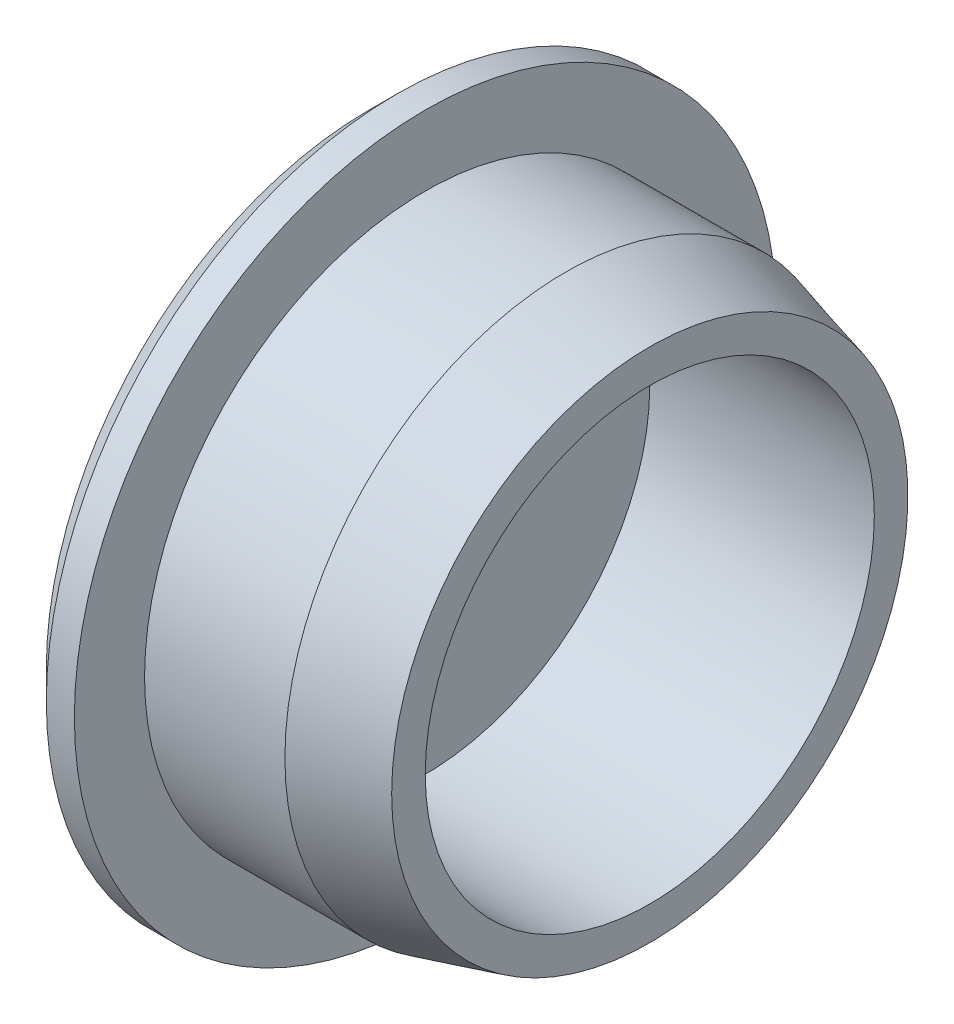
SolidWorks part; units mm, degrees
ref_plane "Plan de face" through (0, 0, 0) normal (0, 0, 1) x (1, 0, 0)
ref_plane "Plan de dessus" through (0, 0, 0) normal (0, 1, 0) x (1, 0, 0)
ref_plane "Plan de droite" through (0, 0, 0) normal (1, 0, 0) x (0, 0, -1)
sketch "Esquisse1" plane through (0, 0, 0) normal (0, 0, 1) x (1, 0, 0)
  line L0 (0, 9.1962) -> (-3, 10)
  line L1 (0, -55) -> (0, 55) construction
  line L2 (-3, 10) -> (-8, 10)
  line L3 (-8, 10) -> (-8, 12.5)
  line L4 (-8, 12.5) -> (-9, 12.5)
  line L5 (-10, 11.5) -> (-10, 0)
  line L6 (55, 0) -> (-55, 0) construction
  line L7 (-10, 0) -> (-8, 0)
  line L8 (-8, 0) -> (-8, 8)
  line L9 (-8, 8) -> (0, 8)
  line L10 (0, 8) -> (0, 9.1962)
  line L11 (-9, 12.5) -> (-10, 11.5)
  point P7 (-10, 12.5)
  dimension "D1" = 15
  dimension "D2" = 3
  dimension "D3" = 10
  dimension "D4" = 12.5
  dimension "D5" = 8
  dimension "D6" = 2
  dimension "D7" = 2
revolve "Révolution1" add sketch "Esquisse1" angle 360 about L7
